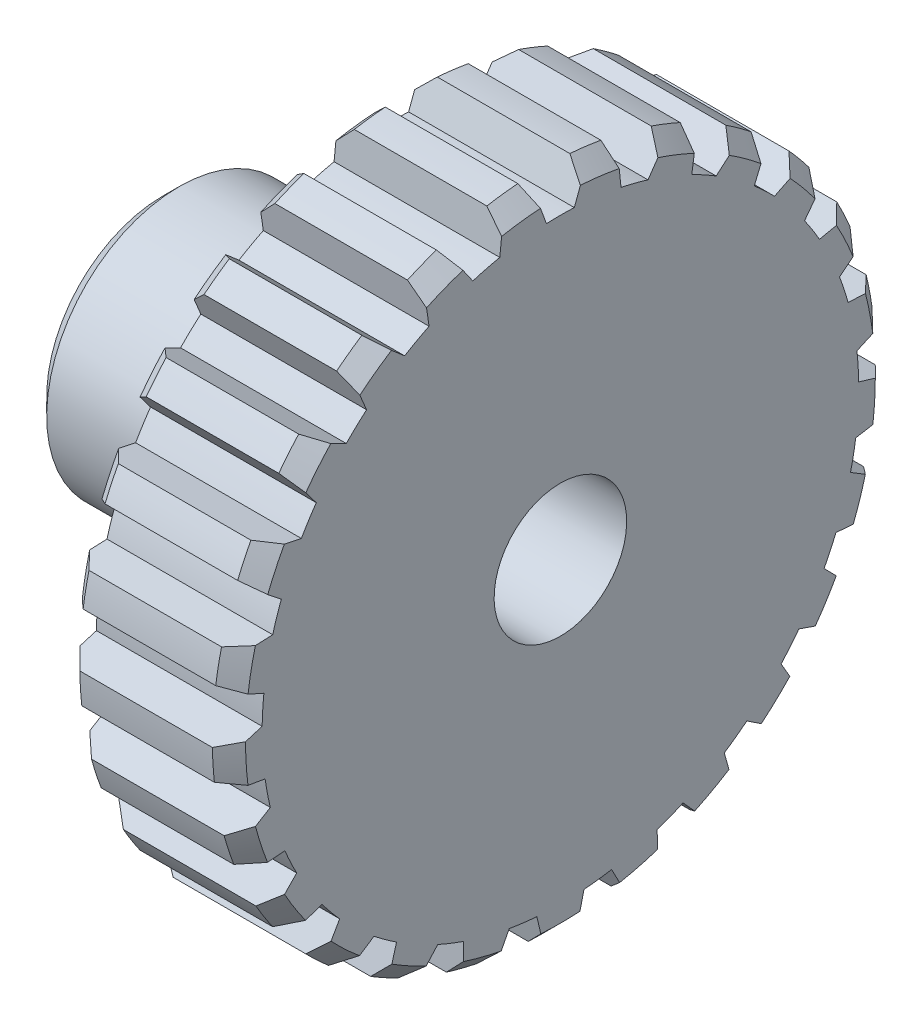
SolidWorks part; units mm, degrees
ref_plane "Front" through (0, 0, 0) normal (0, 0, 1) x (1, 0, 0)
ref_plane "Top" through (0, 0, 0) normal (0, 1, 0) x (1, 0, 0)
ref_plane "Right" through (0, 0, 0) normal (1, 0, 0) x (0, 0, -1)
sketch "Sketch1" plane through (0, 0, 0) normal (0, 0, 1) x (1, 0, 0)
  line L0 (0, 0) -> (-12, 0)
  line L1 (-12, 2) -> (-12, 4)
  line L2 (-12, 4) -> (-5, 4)
  line L3 (-5, 4) -> (-5, 10)
  line L4 (-5, 10) -> (0, 10)
  line L5 (0, 10) -> (0, 2)
  line L6 (0, 2) -> (-12, 2)
  dimension "D1" = 10
  dimension "D2" = 4
  dimension "D3" = 12
  dimension "D4" = 7
revolve "Revolve1" add sketch "Sketch1" angle 360 about L0
sketch "Sketch3" plane through (0, 0, 0) normal (1, 0, 0) x (0, 0, -1)
  line L0 (-0.785, 9.9691) -> (-0.42, 8.9902)
  line L1 (0.785, 9.9691) -> (0.785, 10.7794)
  line L2 (1.9204, 10.636) -> (1.7189, 9.8512)
  line L3 (-0.785, 10.7794) -> (-0.785, 9.9691)
  line L4 (1.7189, 9.8512) -> (1.829, 8.8122)
  line L5 (0.42, 8.9902) -> (0.785, 9.9691)
  line L6 (2.6426, 8.6033) -> (3.2396, 9.4607)
  line L7 (3.2396, 9.4607) -> (3.4411, 10.2455)
  line L8 (4.5051, 9.8243) -> (4.1148, 9.1142)
  line L9 (4.1148, 9.1142) -> (3.963, 8.0805)
  line L10 (4.6991, 7.6758) -> (5.4906, 8.3578)
  line L11 (5.4906, 8.3578) -> (5.8809, 9.0679)
  line L12 (6.8068, 8.3952) -> (6.2521, 7.8046)
  line L13 (6.2521, 7.8046) -> (5.848, 6.8411)
  line L14 (6.4604, 6.2661) -> (7.3966, 6.7298)
  line L15 (7.3966, 6.7298) -> (7.9513, 7.3205)
  line L16 (8.6807, 6.4387) -> (7.9966, 6.0045)
  line L17 (7.9966, 6.0045) -> (7.3656, 5.1718)
  line L18 (7.8157, 4.4626) -> (8.8378, 4.6789)
  line L19 (8.8378, 4.6789) -> (9.522, 5.1131)
  line L20 (10.0093, 4.0776) -> (9.2386, 3.8272)
  line L21 (9.2386, 3.8272) -> (8.4204, 3.1776)
  line L22 (8.68, 2.3787) -> (9.7238, 2.3341)
  line L23 (9.7238, 2.3341) -> (10.4944, 2.5844)
  line L24 (10.7089, 1.4603) -> (9.9002, 1.4094)
  line L25 (9.9002, 1.4094) -> (8.9461, 0.9837)
  line L26 (8.9988, 0.1453) -> (9.9988, -0.1575)
  line L27 (9.9988, -0.1575) -> (10.8074, -0.1066)
  line L28 (10.7356, -1.2488) -> (9.9397, -1.0969)
  line L29 (9.9397, -1.0969) -> (8.9097, -1.272)
  line L30 (8.7523, -2.0972) -> (9.6455, -2.6391)
  line L31 (9.6455, -2.6391) -> (10.4414, -2.791)
  line L32 (10.0878, -3.8794) -> (9.3546, -3.5344)
  line L33 (9.3546, -3.5344) -> (8.3134, -3.4478)
  line L34 (7.9557, -4.2079) -> (8.6861, -4.9549)
  line L35 (8.6861, -4.9549) -> (9.4193, -5.2999)
  line L36 (8.8061, -6.2662) -> (8.1817, -5.7497)
  line L37 (8.1817, -5.7497) -> (7.1948, -5.407)
  line L38 (6.6593, -6.0542) -> (7.181, -6.9594)
  line L39 (7.181, -6.9594) -> (7.8053, -7.4759)
  line L40 (6.9711, -8.2593) -> (6.4948, -7.6038)
  line L41 (6.4948, -7.6038) -> (5.6241, -7.0264)
  line L42 (4.9445, -7.5201) -> (5.2246, -8.5266)
  line L43 (5.2246, -8.5266) -> (5.7009, -9.1821)
  line L44 (4.698, -9.7335) -> (4.3998, -8.9801)
  line L45 (4.3998, -8.9801) -> (3.7, -8.2043)
  line L46 (2.919, -8.5135) -> (2.94, -9.5581)
  line L47 (2.94, -9.5581) -> (3.2383, -10.3114)
  line L48 (2.1298, -10.596) -> (2.0283, -9.7921)
  line L49 (2.0283, -9.7921) -> (1.5435, -8.8667)
  line L50 (0.7101, -8.9719) -> (0.4707, -9.9889)
  line L51 (0.4707, -9.9889) -> (0.5722, -10.7928)
  line L52 (-0.5722, -10.7928) -> (-0.4707, -9.9889)
  line L53 (-0.4707, -9.9889) -> (-0.7101, -8.9719)
  line L54 (-1.5435, -8.8667) -> (-2.0283, -9.7921)
  line L55 (-2.0283, -9.7921) -> (-2.1298, -10.596)
  line L56 (-3.2383, -10.3114) -> (-2.94, -9.5581)
  line L57 (-2.94, -9.5581) -> (-2.919, -8.5135)
  line L58 (-3.7, -8.2043) -> (-4.3998, -8.9801)
  line L59 (-4.3998, -8.9801) -> (-4.698, -9.7335)
  line L60 (-5.7009, -9.1821) -> (-5.2246, -8.5266)
  line L61 (-5.2246, -8.5266) -> (-4.9445, -7.5201)
  line L62 (-5.6241, -7.0264) -> (-6.4948, -7.6038)
  line L63 (-6.4948, -7.6038) -> (-6.9711, -8.2593)
  line L64 (-7.8053, -7.4759) -> (-7.181, -6.9594)
  line L65 (-7.181, -6.9594) -> (-6.6593, -6.0542)
  line L66 (-7.1948, -5.407) -> (-8.1817, -5.7497)
  line L67 (-8.1817, -5.7497) -> (-8.8061, -6.2662)
  line L68 (-9.4193, -5.2999) -> (-8.6861, -4.9549)
  line L69 (-8.6861, -4.9549) -> (-7.9557, -4.2079)
  line L70 (-8.3134, -3.4478) -> (-9.3546, -3.5344)
  line L71 (-9.3546, -3.5344) -> (-10.0878, -3.8794)
  line L72 (-10.4414, -2.791) -> (-9.6455, -2.6391)
  line L73 (-9.6455, -2.6391) -> (-8.7523, -2.0972)
  line L74 (-8.9097, -1.272) -> (-9.9397, -1.0969)
  line L75 (-9.9397, -1.0969) -> (-10.7356, -1.2488)
  line L76 (-10.8074, -0.1066) -> (-9.9988, -0.1575)
  line L77 (-9.9988, -0.1575) -> (-8.9988, 0.1453)
  line L78 (-8.9461, 0.9837) -> (-9.9002, 1.4094)
  line L79 (-9.9002, 1.4094) -> (-10.7089, 1.4603)
  line L80 (-10.4944, 2.5844) -> (-9.7238, 2.3341)
  line L81 (-9.7238, 2.3341) -> (-8.68, 2.3787)
  line L82 (-8.4204, 3.1776) -> (-9.2386, 3.8272)
  line L83 (-9.2386, 3.8272) -> (-10.0093, 4.0776)
  line L84 (-9.522, 5.1131) -> (-8.8378, 4.6789)
  line L85 (-8.8378, 4.6789) -> (-7.8157, 4.4626)
  line L86 (-7.3656, 5.1718) -> (-7.9966, 6.0045)
  line L87 (-7.9966, 6.0045) -> (-8.6807, 6.4387)
  line L88 (-7.9513, 7.3205) -> (-7.3966, 6.7298)
  line L89 (-7.3966, 6.7298) -> (-6.4604, 6.2661)
  line L90 (-5.848, 6.8411) -> (-6.2521, 7.8046)
  line L91 (-6.2521, 7.8046) -> (-6.8068, 8.3952)
  line L92 (-5.8809, 9.0679) -> (-5.4906, 8.3578)
  line L93 (-5.4906, 8.3578) -> (-4.6991, 7.6758)
  line L94 (-3.963, 8.0805) -> (-4.1148, 9.1142)
  line L95 (-4.1148, 9.1142) -> (-4.5051, 9.8243)
  line L96 (-3.4411, 10.2455) -> (-3.2396, 9.4607)
  line L97 (-3.2396, 9.4607) -> (-2.6426, 8.6033)
  line L98 (-1.829, 8.8122) -> (-1.7189, 9.8512)
  line L99 (-1.7189, 9.8512) -> (-1.9204, 10.636)
  arc A0 (3.4411, 10.2455) -> (1.9204, 10.636) centre (0, 0) ccw
  arc A1 (0.42, 8.9902) -> (-0.42, 8.9902) centre (0, 0) ccw
  arc A2 (0.785, 10.7794) -> (-0.785, 10.7794) centre (0, 0) ccw
  arc A3 (2.6426, 8.6033) -> (1.829, 8.8122) centre (0, 0) ccw
  arc A4 (5.8809, 9.0679) -> (4.5051, 9.8243) centre (0, 0) ccw
  arc A5 (4.6991, 7.6758) -> (3.963, 8.0805) centre (0, 0) ccw
  arc A6 (7.9513, 7.3205) -> (6.8068, 8.3952) centre (0, 0) ccw
  arc A7 (6.4604, 6.2661) -> (5.848, 6.8411) centre (0, 0) ccw
  arc A8 (9.522, 5.1131) -> (8.6807, 6.4387) centre (0, 0) ccw
  arc A9 (7.8157, 4.4626) -> (7.3656, 5.1718) centre (0, 0) ccw
  arc A10 (10.4944, 2.5844) -> (10.0093, 4.0776) centre (0, 0) ccw
  arc A11 (8.68, 2.3787) -> (8.4204, 3.1776) centre (0, 0) ccw
  arc A12 (10.8074, -0.1066) -> (10.7089, 1.4603) centre (0, 0) ccw
  arc A13 (8.9988, 0.1453) -> (8.9461, 0.9837) centre (0, 0) ccw
  arc A14 (10.4414, -2.791) -> (10.7356, -1.2488) centre (0, 0) ccw
  arc A15 (8.7523, -2.0972) -> (8.9097, -1.272) centre (0, 0) ccw
  arc A16 (9.4193, -5.2999) -> (10.0878, -3.8794) centre (0, 0) ccw
  arc A17 (7.9557, -4.2079) -> (8.3134, -3.4478) centre (0, 0) ccw
  arc A18 (7.8053, -7.4759) -> (8.8061, -6.2662) centre (0, 0) ccw
  arc A19 (6.6593, -6.0542) -> (7.1948, -5.407) centre (0, 0) ccw
  arc A20 (5.7009, -9.1821) -> (6.9711, -8.2593) centre (0, 0) ccw
  arc A21 (4.9445, -7.5201) -> (5.6241, -7.0264) centre (0, 0) ccw
  arc A22 (3.2383, -10.3114) -> (4.698, -9.7335) centre (0, 0) ccw
  arc A23 (2.919, -8.5135) -> (3.7, -8.2043) centre (0, 0) ccw
  arc A24 (0.5722, -10.7928) -> (2.1298, -10.596) centre (0, 0) ccw
  arc A25 (0.7101, -8.9719) -> (1.5435, -8.8667) centre (0, 0) ccw
  arc A26 (-2.1298, -10.596) -> (-0.5722, -10.7928) centre (0, 0) ccw
  arc A27 (-1.5435, -8.8667) -> (-0.7101, -8.9719) centre (0, 0) ccw
  arc A28 (-4.698, -9.7335) -> (-3.2383, -10.3114) centre (0, 0) ccw
  arc A29 (-3.7, -8.2043) -> (-2.919, -8.5135) centre (0, 0) ccw
  arc A30 (-6.9711, -8.2593) -> (-5.7009, -9.1821) centre (0, 0) ccw
  arc A31 (-5.6241, -7.0264) -> (-4.9445, -7.5201) centre (0, 0) ccw
  arc A32 (-8.8061, -6.2662) -> (-7.8053, -7.4759) centre (0, 0) ccw
  arc A33 (-7.1948, -5.407) -> (-6.6593, -6.0542) centre (0, 0) ccw
  arc A34 (-10.0878, -3.8794) -> (-9.4193, -5.2999) centre (0, 0) ccw
  arc A35 (-8.3134, -3.4478) -> (-7.9557, -4.2079) centre (0, 0) ccw
  arc A36 (-10.7356, -1.2488) -> (-10.4414, -2.791) centre (0, 0) ccw
  arc A37 (-8.9097, -1.272) -> (-8.7523, -2.0972) centre (0, 0) ccw
  arc A38 (-10.7089, 1.4603) -> (-10.8074, -0.1066) centre (0, 0) ccw
  arc A39 (-8.9461, 0.9837) -> (-8.9988, 0.1453) centre (0, 0) ccw
  arc A40 (-10.0093, 4.0776) -> (-10.4944, 2.5844) centre (0, 0) ccw
  arc A41 (-8.4204, 3.1776) -> (-8.68, 2.3787) centre (0, 0) ccw
  arc A42 (-8.6807, 6.4387) -> (-9.522, 5.1131) centre (0, 0) ccw
  arc A43 (-7.3656, 5.1718) -> (-7.8157, 4.4626) centre (0, 0) ccw
  arc A44 (-6.8068, 8.3952) -> (-7.9513, 7.3205) centre (0, 0) ccw
  arc A45 (-5.848, 6.8411) -> (-6.4604, 6.2661) centre (0, 0) ccw
  arc A46 (-4.5051, 9.8243) -> (-5.8809, 9.0679) centre (0, 0) ccw
  arc A47 (-3.963, 8.0805) -> (-4.6991, 7.6758) centre (0, 0) ccw
  arc A48 (-1.9204, 10.636) -> (-3.4411, 10.2455) centre (0, 0) ccw
  arc A49 (-1.829, 8.8122) -> (-2.6426, 8.6033) centre (0, 0) ccw
chamfer "Chamfer4" distance 0.5 angle 45 3 edges at (0, 10, 0) (-5, 10, 0) (-12, 4, 0)
extrude "Cut-Extrude2" cut sketch "Sketch3" against normal blind 10
